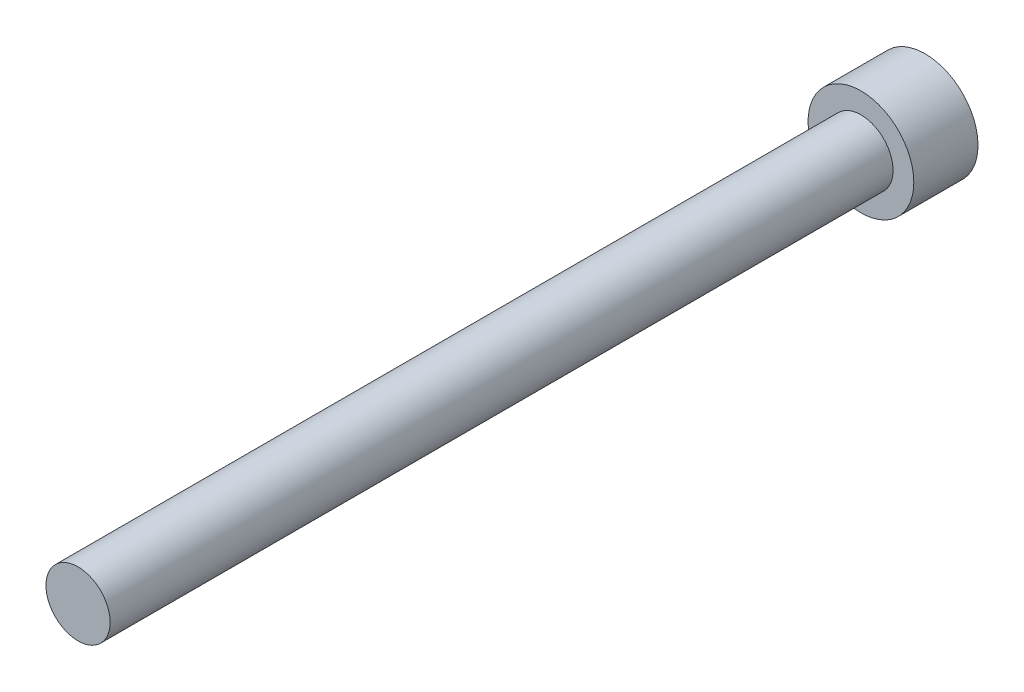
SolidWorks part; units mm, degrees
ref_plane "Front Plane" through (0, 0, 0) normal (0, 0, 1) x (1, 0, 0)
ref_plane "Top Plane" through (0, 0, 0) normal (0, 1, 0) x (1, 0, 0)
ref_plane "Right Plane" through (0, 0, 0) normal (1, 0, 0) x (0, 0, -1)
sketch "Sketch6" plane through (0, 0, 0) normal (1, 0, 0) x (0, 0, -1)
  line L0 (-50.8, 0) -> (22.525, 0) construction
  line L1 (3.7719, 0) -> (-3.7719, 0) construction
  line L2 (-50.8, 0) -> (-50.8, -2.0828)
  line L3 (-50.8, -2.0828) -> (0, -2.0828)
  line L4 (0, 3.7719) -> (0, -3.7719) construction
  line L5 (0, -2.0828) -> (0, -3.429)
  line L6 (0, -3.429) -> (4.1656, -3.429)
  line L7 (4.1656, -3.429) -> (4.1656, 0)
  line L8 (4.1656, 0) -> (-50.8, 0)
  dimension "L" = 50.8
  dimension "H" = 4.1656
  dimension "A" = 6.858
  dimension "D" = 4.1656
revolve "Revolve1" add sketch "Sketch6" angle 360 about L0
sketch "Sketch7" plane through (0, 0, -4.1656) normal (0, 0, -1) x (-1, 0, 0)
  line L2 (-1.778, 1.0265) -> (-1.778, -1.0265)
  line L4 (-1.778, -1.0265) -> (0, -2.0531)
  line L5 (0, -2.0531) -> (1.778, -1.0265)
  line L6 (1.778, -1.0265) -> (1.778, 1.0265)
  line L7 (1.778, 1.0265) -> (0, 2.0531)
  line L8 (0, 2.0531) -> (-1.778, 1.0265)
  circle A0 centre (0, 0) radius 1.778 construction
  dimension "J" = 3.556
extrude "HEX" cut sketch "Sketch7" against normal blind 2.794
